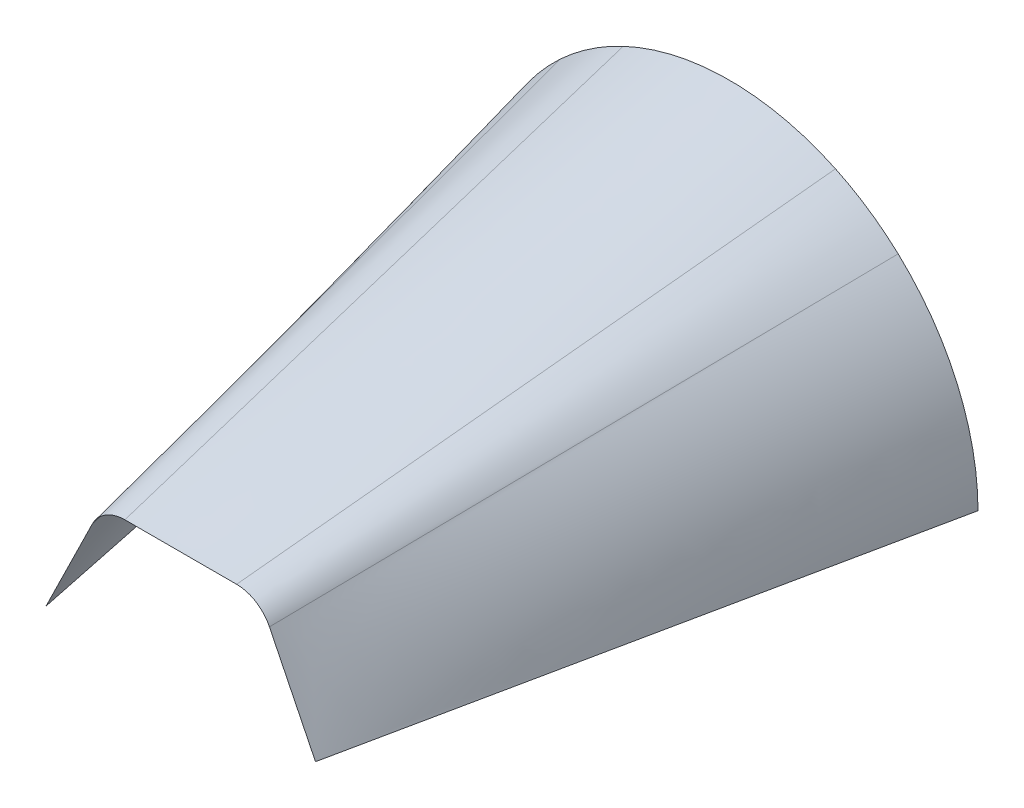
SolidWorks part; units mm, degrees
ref_plane "Front" through (0, 0, 0) normal (0, 0, 1) x (1, 0, 0)
ref_plane "Top" through (0, 0, 0) normal (0, 1, 0) x (1, 0, 0)
ref_plane "Right" through (0, 0, 0) normal (1, 0, 0) x (0, 0, -1)
sketch "Sketch1" plane through (0, 0, 0) normal (0, 0, 1) x (1, 0, 0)
  line L0 (-36.8419, 0) -> (-24.2527, 25.639)
  line L1 (-15.2764, 31.2315) -> (15.2764, 31.2315)
  line L2 (24.2527, 25.639) -> (36.8419, 0)
  arc A0 (-24.2527, 25.639) -> (-15.2764, 31.2315) centre (-15.2764, 21.2315) cw
  arc A1 (15.2764, 31.2315) -> (24.2527, 25.639) centre (15.2764, 21.2315) cw
  dimension "D1" = 10
ref_plane "Plane1" through (0, 0, -150) normal (0, 0, 1) x (1, 0, 0)
sketch "Sketch2" plane through (0, 0, -150) normal (0, 0, 1) x (1, 0, 0)
  arc A0 (-67.9833, 0) -> (67.9833, 0) centre (0, 0) cw
surface "Surface-Loft3"
